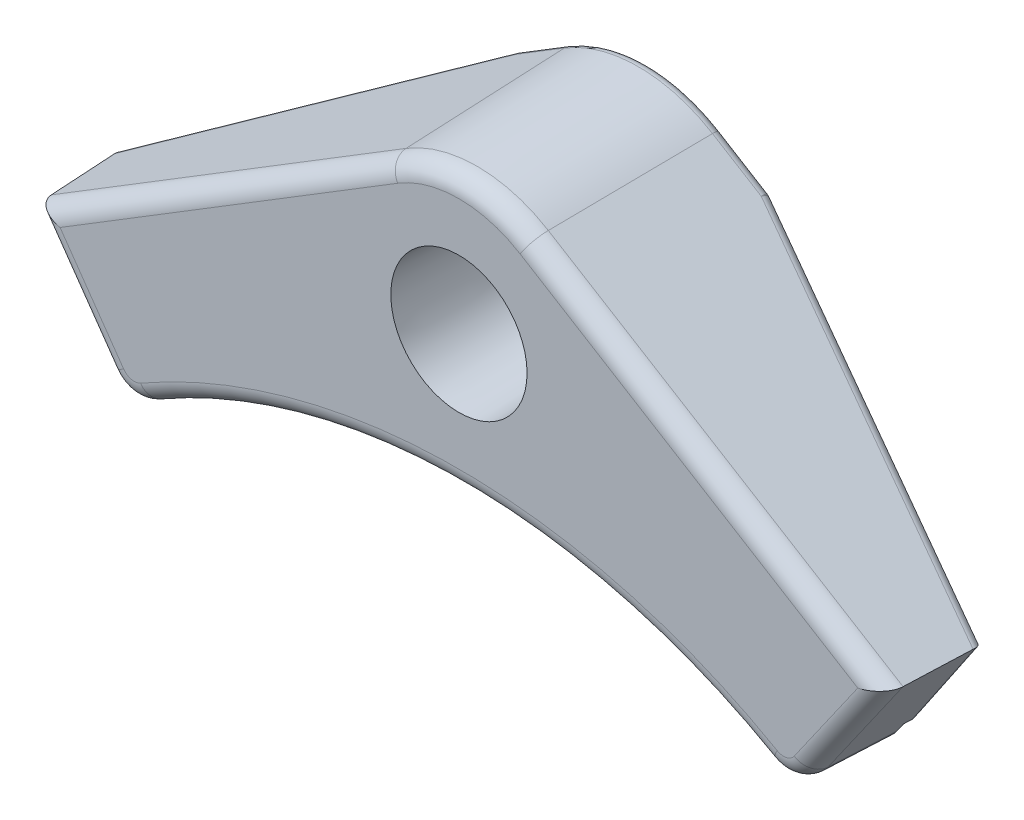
SolidWorks part; units mm, degrees
ref_plane "Face" through (0, 0, 0) normal (0, 0, 1) x (1, 0, 0)
ref_plane "Dessus" through (0, 0, 0) normal (0, 1, 0) x (1, 0, 0)
ref_plane "Droite" through (0, 0, 0) normal (1, 0, 0) x (0, 0, -1)
sketch "Esquisse1" plane through (0, 0, 0) normal (0, 0, 1) x (1, 0, 0)
  line L0 (18.7926, 28.7858) -> (22.9483, 34.7207)
  line L1 (-18.7926, 28.7858) -> (-22.9483, 34.7207)
  line L2 (3.9219, 46.3929) -> (22.9483, 34.7207)
  line L3 (-3.9219, 46.3929) -> (-22.9483, 34.7207)
  line L6 (0, 0) -> (0, 96.2966) construction
  arc A0 (-16.1598, 28.1977) -> (-18.7926, 28.7858) centre (-17.1543, 29.9329) cw
  circle A1 centre (0, 40) radius 3.25
  arc A2 (16.1598, 28.1977) -> (18.7926, 28.7858) centre (17.1543, 29.9329) ccw
  arc A5 (3.9219, 46.3929) -> (-3.9219, 46.3929) centre (0, 40) ccw
  arc A9 (16.1598, 28.1977) -> (-16.1598, 28.1977) centre (0, 0) ccw
  dimension "D1" = 35
  dimension "D2" = 40
  dimension "D4" = 65
  dimension "D3" = 15
  dimension "D5" = 2
  dimension "D6" = 6.5
extrude "Extrusion1" add sketch "Esquisse1" along normal blind 10 draft 2
sketch "Esquisse3" plane through (0, 0, 0) normal (0, 0, -1) x (-1, 0, 0)
  line L2 (21.3795, 32.1636) -> (21.3795, 24.0109)
  line L3 (21.3795, 24.0109) -> (-21.3795, 24.0109)
  line L4 (2.3531, 43.8357) -> (21.3795, 32.1636)
  line L5 (-21.3795, 32.1636) -> (-2.3531, 43.8357)
  line L6 (2.3531, 43.8357) -> (21.3795, 32.1636)
  line L7 (-21.3795, 32.1636) -> (-2.3531, 43.8357)
  line L8 (-21.3795, 24.0109) -> (-21.3795, 32.1636)
  arc A2 (2.3531, 43.8357) -> (-2.3531, 43.8357) centre (0, 40) ccw
  arc A3 (2.3531, 43.8357) -> (-2.3531, 43.8357) centre (0, 40) ccw
  dimension "D1" = 3
extrude "Enlèv. mat.-Extru.1" cut sketch "Esquisse3" against normal blind 5 draft 2
sketch "Esquisse4" plane through (0, 0, 5) normal (0, 0, -1) x (-1, 0, 0)
  circle A0 centre (0, 0) radius 35
  dimension "D1" = 70
extrude "Enlèv. mat.-Extru.2" cut sketch "Esquisse4" against normal blind 0.5
sketch "Esquisse5" plane through (21.7243, 35.4121, 1.4508) normal (0.5226, 0.8519, 0.0349) x (-0.8526, 0.5222, 0.0214)
  line L0 (17.8644, -1.8345) -> (-1.143, 3.5767)
  line L1 (-1.4356, -1.4213) -> (20.8807, -1.899) construction
  line L2 (-0.8504, 8.5746) -> (-1.4356, -1.4213) construction
  line L3 (-1.143, 3.5767) -> (-3.227, -3.7438)
  line L4 (-3.227, -3.7438) -> (17.8644, -1.8345)
extrude "Enlèv. mat.-Extru.3" cut sketch "Esquisse5" against normal through all
mirror "Symétrie1" about plane through (0, 0, 0) normal (1, 0, 0)
sketch "Esquisse6" plane through (0, 0, 5) normal (0, 0, -1) x (-1, 0, 0)
  line L0 (5.2658, 42.0489) -> (2.3531, 43.8357) construction
  line L1 (-2.3531, 43.8357) -> (-5.2658, 42.0489) construction
  line L2 (5.2658, 42.0489) -> (2.3531, 43.8357)
  line L3 (-2.3531, 43.8357) -> (-5.2658, 42.0489)
  line L4 (-5.2658, 42.0489) -> (-5.2658, 34.6016)
  line L5 (5.2658, 42.0489) -> (5.2658, 34.6016)
  arc A0 (19.0036, 29.3916) -> (-19.0036, 29.3916) centre (0, 0) ccw construction
  arc A1 (2.3531, 43.8357) -> (-2.3531, 43.8357) centre (0, 40) ccw construction
  arc A2 (5.2658, 34.6016) -> (-5.2658, 34.6016) centre (0, 0) ccw
  arc A3 (2.3531, 43.8357) -> (-2.3531, 43.8357) centre (0, 40) ccw
  circle A4 centre (0, 40) radius 3.4246
extrude "Extrusion2" add sketch "Esquisse6" along normal blind 5 draft 2
fillet "Congé1" radius 0.5
fillet "Congé2" radius 1
